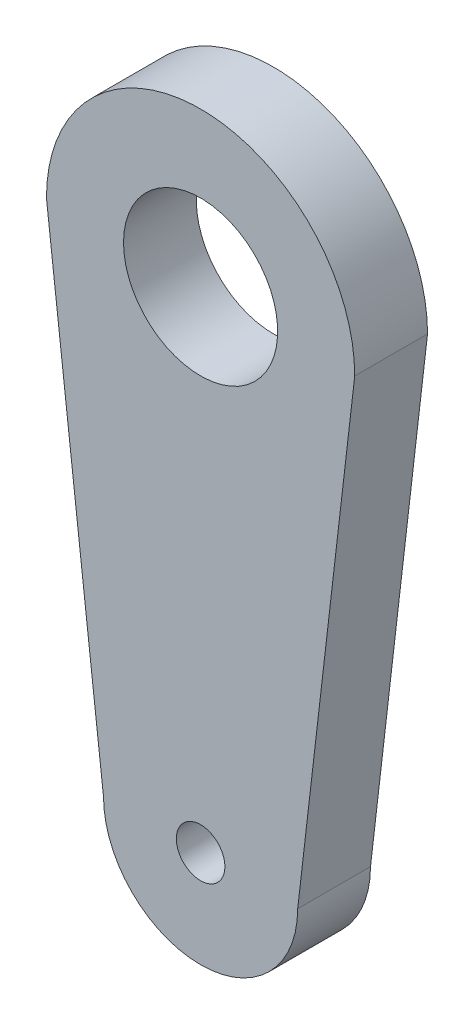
SolidWorks part; units mm, degrees
ref_plane "Front Plane" through (0, 0, 0) normal (0, 0, 1) x (1, 0, 0)
ref_plane "Top Plane" through (0, 0, 0) normal (0, 1, 0) x (1, 0, 0)
ref_plane "Right Plane" through (0, 0, 0) normal (1, 0, 0) x (0, 0, -1)
sketch "Sketch1" plane through (0, 0, 0) normal (0, 0, 1) x (1, 0, 0)
  line L1 (-6.35, 0) -> (6.35, 0)
  line L2 (-6.35, 0) -> (-4, -20.1837)
  line L3 (-4, -20.1837) -> (4, -20.1837)
  line L4 (6.35, 0) -> (4, -20.1837)
  arc A1 (6.35, 0) -> (-6.35, 0) centre (0, 0) ccw
  arc A2 (-4, -20.1837) -> (4, -20.1837) centre (0, -20.1837) ccw
  circle A3 centre (0, 0) radius 3.175
  circle A4 centre (0, -20.1837) radius 1
  point P5 (0, 0)
extrude "Boss-Extrude1" add sketch "Sketch1" along normal mid plane 2.9997 contours A4 L3 L4 L1 A3 L2 | A3 L1 A1 | A4 L3 A2
equation "\"pin hole\"= 2mm"
equation "\"dowel thick\"= 1 / 4"
equation "\"ply thick\"= 3mm"
equation "\"extend length\"= 0.8"
equation "\"D1@Sketch1\"=\"extend length\""
equation "\"D2@Sketch1\"=\"dowel thick\""
equation "\"D3@Sketch1\"=\"pin hole\""
equation "\"D4@Sketch1\"=\"dowel thick\"*2"
equation "\"D5@Sketch1\"=\"pin hole\"*4"
equation "\"D1@Boss-Extrude1\"=\"ply thick\""
